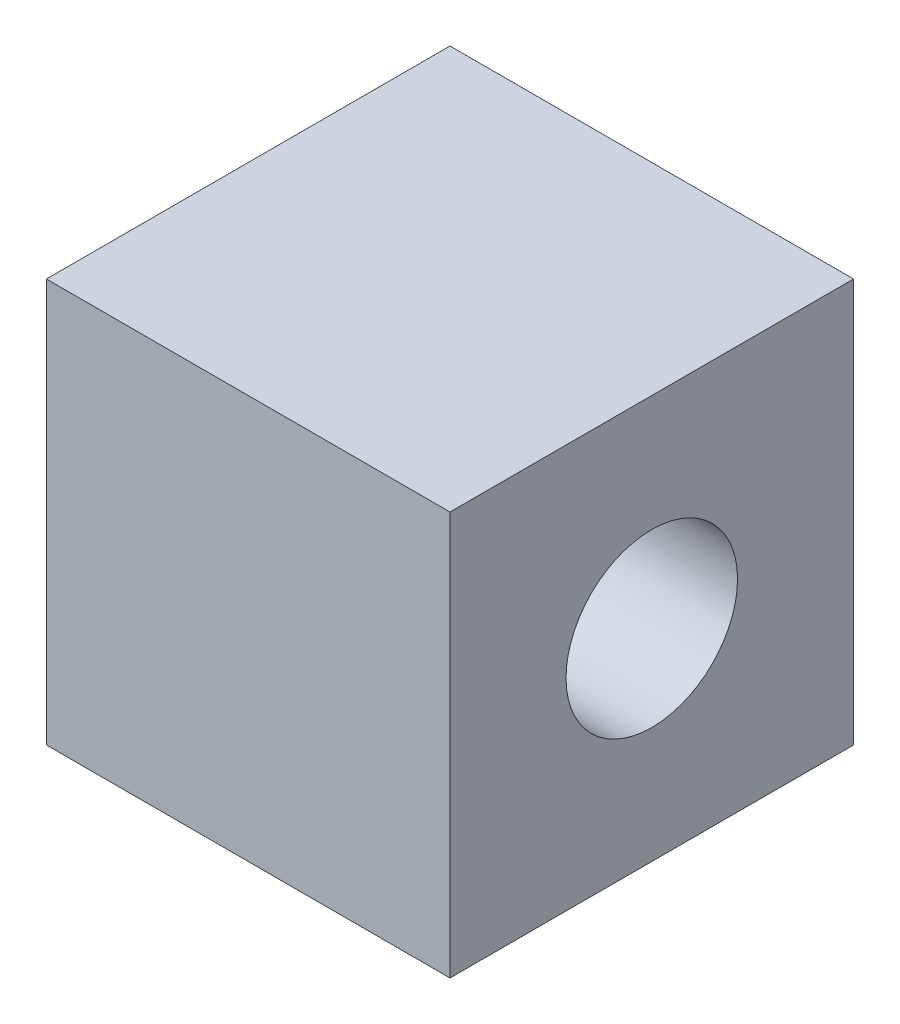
SolidWorks part; units mm, degrees
ref_plane "Front Plane" through (0, 0, 0) normal (0, 0, 1) x (1, 0, 0)
ref_plane "Top Plane" through (0, 0, 0) normal (0, 1, 0) x (1, 0, 0)
ref_plane "Right Plane" through (0, 0, 0) normal (1, 0, 0) x (0, 0, -1)
sketch "Sketch1" plane through (0, 0, 0) normal (1, 0, 0) x (0, 0, -1)
  line L1 (-10, -10) -> (10, -10)
  line L2 (-10, -10) -> (-10, 10)
  line L3 (-10, 10) -> (10, 10)
  line L4 (10, -10) -> (10, 10)
  line L5 (-10, -10) -> (10, 10) construction
  line L6 (-10, 10) -> (10, -10) construction
  point P0 (0, 0)
  dimension "D1" = 20
  dimension "D2" = 20
extrude "Boss-Extrude1" add sketch "Sketch1" along normal blind 20
sketch "Sketch2" plane through (20, 0, 0) normal (1, 0, 0) x (0, 0, -1)
  circle A0 centre (0, 0) radius 4.25
  dimension "D1" = 8.5
extrude "Cut-Extrude1" cut sketch "Sketch2" against normal through all
